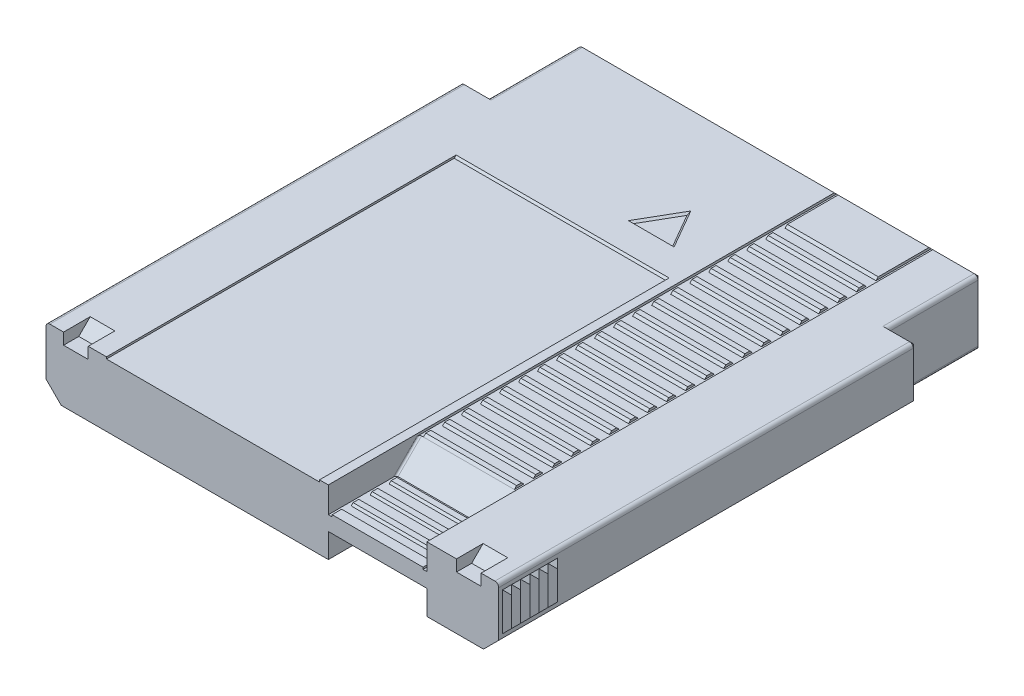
SolidWorks part; units mm, degrees
ref_plane "Front Plane" through (0, 0, 0) normal (0, 0, 1) x (1, 0, 0)
ref_plane "Top Plane" through (0, 0, 0) normal (0, 1, 0) x (1, 0, 0)
ref_plane "Right Plane" through (0, 0, 0) normal (1, 0, 0) x (0, 0, -1)
sketch "Sketch1" plane through (0, 0, 0) normal (0, 1, 0) x (1, 0, 0)
  line L0 (0, 0) -> (119, 0)
  line L1 (119, 0) -> (119, 110)
  line L2 (119, 110) -> (112, 110)
  line L3 (112, 110) -> (112, 134)
  line L4 (112, 134) -> (7, 134)
  line L5 (7, 134) -> (7, 110)
  line L6 (7, 110) -> (0, 110)
  line L7 (0, 110) -> (0, 0)
  dimension "D1" = 7
  dimension "D2" = 7
  dimension "D3" = 24
  dimension "D4" = 134
  dimension "D5" = 119
extrude "Boss-Extrude1" add sketch "Sketch1" along normal blind 17
sketch "Sketch2" plane through (0, 17, 0) normal (0, 1, 0) x (1, 0, 0)
  line L0 (0, 0) -> (119, 0) construction
  line L1 (15.9, 0) -> (71.9, 0)
  line L2 (15.9, 0) -> (15.9, 50.2)
  line L3 (15.9, 50.2) -> (71.9, 50.2)
  line L4 (71.9, 0) -> (71.9, 50.2)
  line L5 (0, 110) -> (0, 0) construction
  line L6 (119.5, 53.2) -> (-0.5, 53.2) construction
  dimension "D1" = 15.9
  dimension "D2" = 3
  dimension "D3" = 56
extrude "Cut-Extrude1" cut sketch "Sketch2" against normal blind 0.5
sketch "Sketch3" plane through (0, 17, 0) normal (0, 1, 0) x (1, 0, 0)
  line L0 (71.9, 50.2) -> (15.9, 50.2)
  line L1 (15.9, 50.2) -> (15.9, 91.4)
  line L2 (15.9, 91.4) -> (71.9, 91.4)
  line L3 (71.9, 91.4) -> (71.9, 50.2)
  line L5 (7, 110) -> (0, 110) construction
  dimension "D1" = 18.6
extrude "Cut-Extrude2" cut sketch "Sketch3" against normal blind 0.5
sketch "Sketch4" plane through (0, 17, 0) normal (0, 1, 0) x (1, 0, 0)
  line L0 (71.9, 0) -> (119, 0) construction
  line L1 (100.12, 0) -> (74.22, 0)
  line L2 (100.12, 0) -> (100.12, 17.82)
  line L3 (100.12, 17.82) -> (74.22, 17.82)
  line L4 (74.22, 0) -> (74.22, 17.82)
  line L5 (119, 0) -> (119, 110) construction
  dimension "D1" = 25.9
  dimension "D2" = 17.82
  dimension "D3" = 18.88
extrude "Cut-Extrude3" cut sketch "Sketch4" against normal blind 6.78
sketch "Sketch5" plane through (0, 17, 0) normal (0, 1, 0) x (1, 0, 0)
  line L0 (100.12, 17.82) -> (100.12, 134)
  line L1 (74.22, 17.82) -> (74.22, 134)
  line L2 (74.22, 134) -> (100.12, 134)
  line L4 (100.12, 17.82) -> (74.22, 17.82)
  line L5 (112, 134) -> (7, 134) construction
extrude "Cut-Extrude4" cut sketch "Sketch5" against normal blind 0.6
sketch "Sketch6" plane through (0, 10.22, 0) normal (0, 1, 0) x (1, 0, 0)
  line L0 (74.22, 0) -> (100.12, 0) construction
  line L1 (99.12, 0) -> (75.22, 0)
  line L2 (99.12, 0) -> (99.12, 2.5)
  line L3 (99.12, 2.5) -> (75.22, 2.5)
  line L4 (75.22, 0) -> (75.22, 2.5)
  line L5 (100.12, 0) -> (100.12, 17.82) construction
  line L6 (74.22, 17.82) -> (74.22, 0) construction
  dimension "D1" = 2.5
  dimension "D2" = 1
  dimension "D3" = 1
extrude "Boss-Extrude2" add sketch "Sketch6" along normal blind 0.5
pattern_linear "LPattern1" count 4 spacing 5 along (0, 0, -1) of "Boss-Extrude2"
chamfer "Chamfer2" distance 6.18 angle 45 1 edges at (87.17, 16.4, -17.82)
sketch "Sketch7" plane through (0, 16.4, 0) normal (0, 1, 0) x (1, 0, 0)
  line L0 (74.22, 24) -> (100.12, 24) construction
  line L1 (99.12, 24) -> (75.22, 24)
  line L2 (99.12, 24) -> (99.12, 26.5)
  line L3 (99.12, 26.5) -> (75.22, 26.5)
  line L4 (75.22, 24) -> (75.22, 26.5)
  line L5 (75.22, 17.5) -> (75.22, 15) construction
  line L6 (99.12, 15) -> (99.12, 17.5) construction
  dimension "D1" = 2.5
extrude "Boss-Extrude3" add sketch "Sketch7" along normal up to surface (0.6 mm away)
chamfer "Chamfer3" distance 0.6 angle 45 2 edges at (87.17, 17, -26.5) (87.17, 17, -24)
pattern_linear "LPattern2" count 19 spacing 5 along (0, 0, -1) of "Boss-Extrude3", "Chamfer3"
chamfer "Chamfer4" distance 0.5 angle 45 6 edges at (87.17, 10.72, -17.5) (87.17, 10.72, -15) (87.17, 10.72, -12.5) (87.17, 10.72, -10) (87.17, 10.72, -7.5) (87.17, 10.72, -5)
sketch "Sketch8" plane through (0, 16.4, 0) normal (0, 1, 0) x (1, 0, 0)
  line L0 (100.12, 134) -> (74.22, 134) construction
  line L1 (99.12, 134) -> (75.22, 134)
  line L2 (99.12, 134) -> (99.12, 119.06)
  line L3 (99.12, 119.06) -> (75.22, 119.06)
  line L4 (75.22, 134) -> (75.22, 119.06)
  line L6 (99.12, 114) -> (99.12, 116.5) construction
  line L7 (75.22, 116.5) -> (75.22, 114) construction
  line L8 (74.22, 134) -> (7, 134) construction
  dimension "D1" = 14.94
extrude "Boss-Extrude4" add sketch "Sketch8" along normal up to surface (0.6 mm away)
chamfer "Chamfer5" distance 0.6 angle 45 1 edges at (87.17, 17, -119.06)
fillet "Fillet2" radius 0.5 2 edges at (74.22, 13.31, -20.91) (100.12, 13.31, -20.91)
fillet "Fillet3" radius 1 4 edges at (7, 17, -122) (0, 17, -55) (112, 17, -122) (119, 17, -55)
chamfer "Chamfer8" distance 4 angle 45 2 edges at (0, 0, -55) (119, 0, -55)
chamfer "Chamfer10" distance 1 angle 45 11 edges at (111.7071, 16.7071, -134) (112, 8, -134) (114.5, 17, -110) (118.7071, 16.7071, -110) (119, 10, -110) (4.5, 17, -110) (0.2929, 16.7071, -110) (0, 10, -110) (41.11, 17, -134) (7.2929, 16.7071, -134) (7, 8, -134)
fillet "Fillet4" radius 1 2 edges at (7, 0, -121.5) (112, 0, -121.5)
chamfer "Chamfer12" distance 1 angle 45 1 edges at (59.5, 0, -134)
sketch "Sketch10" plane through (0, 0, 0) normal (0, -1, 0) x (1, 0, 0)
  line L0 (59.5, -119.7) -> (59.5, 0) construction
  line L1 (4, 0) -> (115, 0) construction
  line L2 (111, -134) -> (8, -134) construction
  line L4 (28.64, -119.7) -> (90.36, -119.7) construction
  line L5 (28.64, -43.1) -> (28.64, -119.7) construction
  circle A0 centre (28.64, -43.1) radius 1.65
  circle A1 centre (90.36, -43.1) radius 1.65
  circle A2 centre (90.36, -119.7) radius 1.65
  circle A3 centre (28.64, -119.7) radius 1.65
  dimension "D1" = 3.3
  dimension "D2" = 76.6
  dimension "D3" = 76.6
  dimension "D4" = 61.72
  dimension "D5" = 61.72
  dimension "D6" = 14.3
extrude "Cut-Extrude6" cut sketch "Sketch10" against normal offset from surface (15 mm away) 2
chamfer "Chamfer11" distance 1.6 angle 45 4 edges at (90.36, 0, -44.75) (28.64, 0, -44.75) (90.36, 0, -121.35) (28.64, 0, -121.35)
ref_plane "Plane1" through (59.5, 0, 0) normal (1, 0, 0) x (0, 0, -1)
sketch "Sketch9" plane through (0, 0, 0) normal (0, 0, 1) x (1, 0, 0)
  line L0 (100.12, 17) -> (118, 17) construction
  line L1 (114.38, 17) -> (107.9, 17)
  line L2 (114.38, 17) -> (114.38, 14)
  line L3 (114.38, 14) -> (107.9, 14)
  line L4 (107.9, 17) -> (107.9, 14)
  line L5 (119, 16) -> (119, 4) construction
  dimension "D1" = 4.62
  dimension "D2" = 3
  dimension "D3" = 6.48
extrude "Cut-Extrude5" cut sketch "Sketch9" against normal blind 4
chamfer "Chamfer7" distance 3 angle 45 1 edges at (111.14, 17, -4)
mirror "Mirror1" about plane through (59.5, 0, 0) normal (1, 0, 0) of "Chamfer7", "Cut-Extrude5"
sketch "Sketch11" plane through (0, 0, 0) normal (0, 0, 1) x (1, 0, 0)
  line L0 (104.01, 17) -> (104.01, 0) construction
  line L1 (100.12, 17) -> (107.9, 17) construction
  line L2 (4, 0) -> (115, 0) construction
  line L3 (104.01, 8.5) -> (30.718, 8.5) construction
  line L4 (74.22, 10.22) -> (74.22, 17) construction
  line L5 (74.22, 0) -> (100.12, 0)
  line L6 (74.22, 0) -> (74.22, 6.4)
  line L7 (74.22, 6.4) -> (100.12, 6.4)
  line L8 (100.12, 0) -> (100.12, 6.4)
  line L9 (100.12, 10.22) -> (100.12, 17) construction
  dimension "D1" = 6.4
extrude "Cut-Extrude7" cut sketch "Sketch11" against normal up to vertex
chamfer "Chamfer13" distance 6.4 angle 45 1 edges at (87.17, 0, -17.82)
sketch "Sketch12" plane through (0, 0, -134) normal (0, 0, -1) x (-1, 0, 0)
  line L0 (-111, 1) -> (-8, 16) construction
  line L2 (-94.925, 14) -> (-24.075, 14)
  line L3 (-94.925, 14) -> (-94.925, 3)
  line L4 (-94.925, 3) -> (-24.075, 3)
  line L5 (-24.075, 14) -> (-24.075, 3)
  line L6 (-94.925, 14) -> (-24.075, 3) construction
  line L7 (-94.925, 3) -> (-24.075, 14) construction
  point P4 (-59.5, 8.5)
  dimension "D1" = 11
  dimension "D2" = 70.85
extrude "Cut-Extrude8" cut sketch "Sketch12" against normal blind 100.6
chamfer "Chamfer15" distance 0.5 angle 45 4 edges at (28.64, 14, -41.45) (90.36, 14, -41.45) (90.36, 14, -118.05) (28.64, 14, -118.05)
sketch "Sketch13" plane through (0, 17, 0) normal (0, 1, 0) x (1, 0, 0)
  line L0 (112, 110) -> (7, 110) construction
  line L1 (59.5, 110) -> (65.5, 99.6077)
  line L2 (65.5, 99.6077) -> (53.5, 99.6077)
  line L3 (53.5, 99.6077) -> (59.5, 110)
  dimension "D1" = 60
  dimension "D2" = 60
  dimension "D3" = 12
extrude "Cut-Extrude9" cut sketch "Sketch13" against normal blind 0.5
chamfer "Chamfer16" distance 0.5 angle 45 3 edges at (62.5, 16.5, -104.8038) (59.5, 16.5, -99.6077) (56.5, 16.5, -104.8038)
chamfer "Chamfer17" distance 0.5 angle 45 1 edges at (43.9, 17, -91.4)
sketch "Sketch14" plane through (119, 0, 0) normal (1, 0, 0) x (0, 0, -1)
  line L0 (0, 10) -> (57.2702, 10) construction
  line L1 (0, 16) -> (0, 4) construction
  line L2 (0, 4) -> (109, 4) construction
  line L3 (1, 5) -> (3.4, 5)
  line L4 (1, 5) -> (1, 15)
  line L5 (1, 15) -> (3.4, 15)
  line L6 (3.4, 5) -> (3.4, 15)
  line L7 (1, 5) -> (3.4, 15) construction
  line L8 (1, 15) -> (3.4, 5) construction
  point P4 (2.2, 10)
  dimension "D1" = 2.4
  dimension "D2" = 1
  dimension "D3" = 1
extrude "Boss-Extrude5" add sketch "Sketch14" along normal blind 1.2
chamfer "Chamfer18" distance 1.2 angle 45 4 edges at (120.2, 5, -2.2) (120.2, 10, -1) (120.2, 15, -2.2) (120.2, 10, -3.4)
mirror "Mirror5" about plane through (59.5, 0, 0) normal (1, 0, 0) of "Chamfer18", "Boss-Extrude5"
pattern_linear "LPattern4" count 6 spacing 2.4 along (0, 0, -1) of "Chamfer18", "Boss-Extrude5", "Mirror5"
sketch "Sketch15" plane through (0, 0, 0) normal (0, -1, 0) x (1, 0, 0)
  line L0 (4, -33.4) -> (115, -33.4) construction
  line L1 (4, 0) -> (4, -110) construction
  line L2 (115, -110) -> (115, 0) construction
  line L4 (94.925, -33.4) -> (24.075, -33.4) construction
  arc A0 (64.5, -33.4) -> (54.5, -33.4) centre (59.5, -33.4) ccw
  ellipse E0 centre (59.5, -33.4) end of major axis (59.5, -27.9) minor radius 5 (64.5, -33.4) -> (54.5, -33.4) cw
  dimension "D1" = 5
  dimension "D2" = 5.5
extrude "Cut-Extrude10" [suppressed] cut sketch "Sketch15" against normal up to surface (14 mm away)
chamfer "Chamfer19" distance 15 angle 60 2 edges at (24.075, 8.5, -134) (94.925, 8.5, -134)
chamfer "Chamfer20" distance 1 angle 60 2 edges at (59.5, 3, -134) (59.5, 14, -134)
equation "\"D2@Sketch1\"=\"D1@Sketch1\""
equation "\"D3@Sketch6\"=\"D2@Sketch6\""
equation "\"D3@Sketch10\"=\"D2@Sketch10\""
equation "\"D5@Sketch10\"=\"D4@Sketch10\""
